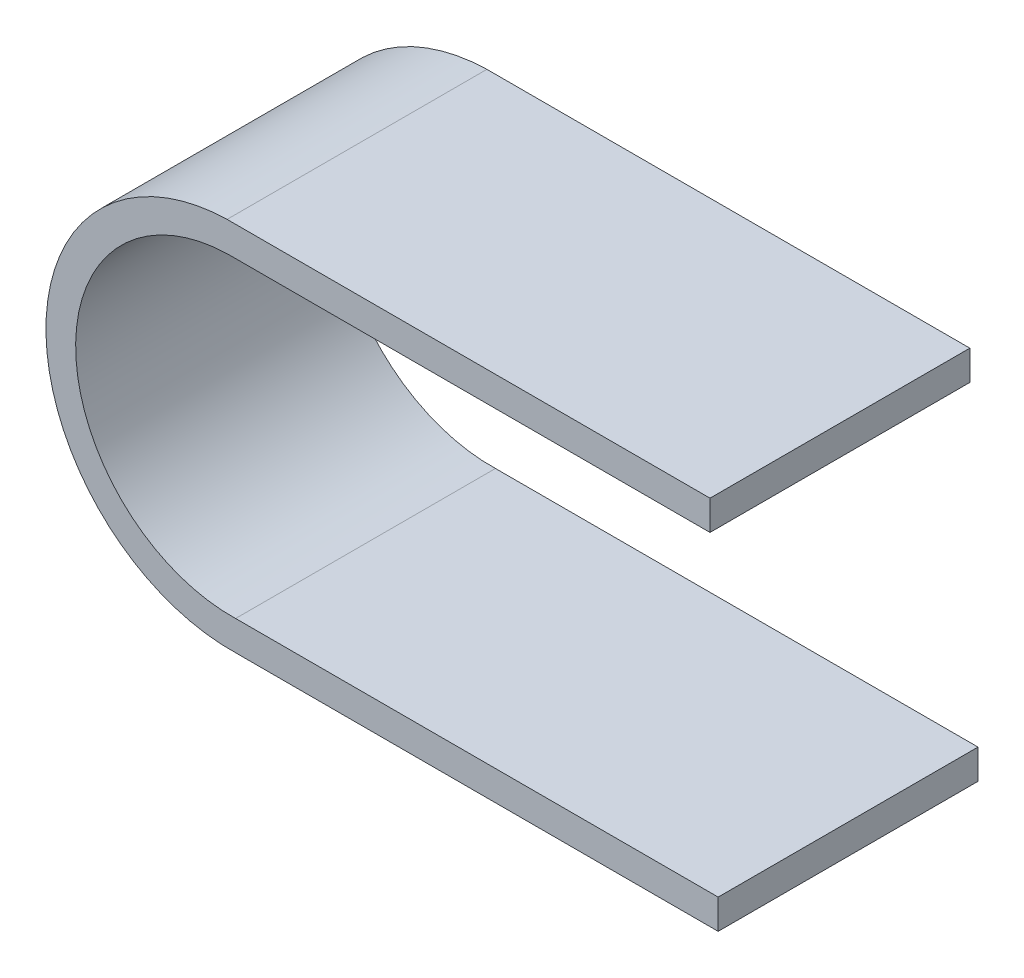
SolidWorks part; units mm, degrees
ref_plane "Plan de face" through (0, 0, 0) normal (0, 0, 1) x (1, 0, 0)
ref_plane "Plan de dessus" through (0, 0, 0) normal (0, 1, 0) x (1, 0, 0)
ref_plane "Plan de droite" through (0, 0, 0) normal (1, 0, 0) x (0, 0, -1)
sketch "Esquisse1" plane through (0, 0, 0) normal (0, 0, 1) x (1, 0, 0)
  line L0 (0, 0) -> (-65, 0)
  line L1 (-1.0987, 41.9856) -> (-66.0987, 41.9856)
  line L2 (-1.0987, 45.9856) -> (-66.1487, 45.9856)
  line L3 (0, -4) -> (-64.95, -4)
  line L4 (-1.0987, 45.9856) -> (-1.0987, 41.9856)
  line L5 (0, 0) -> (0, -4)
  arc A0 (-65, 0) -> (-66.0987, 41.9856) centre (-65.5493, 20.9928) cw
  arc A1 (-64.95, -4) -> (-66.1487, 45.9856) centre (-65.5493, 20.9928) cw
  dimension "D1" = 21
  dimension "D2" = 65
  dimension "D3" = 65
  dimension "D4" = 4
extrude "Boss.-Extru.1" add sketch "Esquisse1" along normal blind 35
